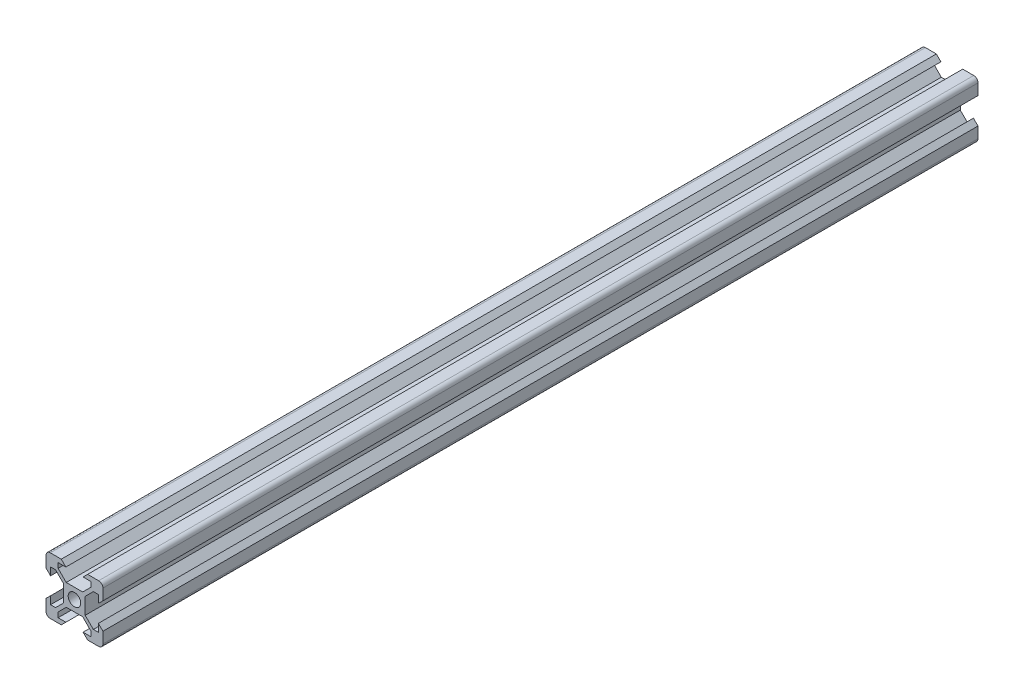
SolidWorks part; units mm, degrees
ref_plane "Front Plane" through (0, 0, 0) normal (0, 0, 1) x (1, 0, 0)
ref_plane "Top Plane" through (0, 0, 0) normal (0, 1, 0) x (1, 0, 0)
ref_plane "Right Plane" through (0, 0, 0) normal (1, 0, 0) x (0, 0, -1)
sketch "Sketch1" plane through (0, 0, 0) normal (0, 0, 1) x (1, 0, 0)
  line L0 (-5.7847, 7.544) -> (-11.512, 13.2713)
  line L1 (-7.544, 7.544) -> (7.544, 7.544)
  line L2 (-7.544, 7.544) -> (-7.544, -7.544)
  line L3 (-7.544, -7.544) -> (7.544, -7.544)
  line L4 (7.544, 7.544) -> (7.544, -7.544)
  line L5 (-7.544, 7.544) -> (7.544, -7.544) construction
  line L6 (-7.544, -7.544) -> (7.544, 7.544) construction
  line L7 (-11.512, 13.2713) -> (-11.512, 16.8)
  line L8 (-11.512, 16.8) -> (-6.052, 16.8)
  line L9 (-6.052, 16.8) -> (-9.252, 20)
  line L10 (-9.252, 20) -> (-17, 20)
  line L11 (-20, 17) -> (-20, 9.252)
  line L12 (-20, 9.252) -> (-16.8, 6.052)
  line L13 (-16.8, 6.052) -> (-16.8, 11.512)
  line L14 (-16.8, 11.512) -> (-13.2713, 11.512)
  line L15 (-13.2713, 11.512) -> (-7.544, 5.7847)
  line L16 (-19.1213, 19.1213) -> (0, 0) construction
  line L17 (13.2713, 11.512) -> (16.8, 11.512)
  line L18 (20, 9.252) -> (20, 17)
  line L19 (17, 20) -> (9.252, 20)
  line L20 (9.252, 20) -> (6.052, 16.8)
  line L21 (6.052, 16.8) -> (11.512, 16.8)
  line L22 (11.512, 16.8) -> (11.512, 13.2713)
  line L23 (11.512, 13.2713) -> (5.7847, 7.544)
  line L24 (7.544, 5.7847) -> (13.2713, 11.512)
  line L25 (16.8, 11.512) -> (16.8, 6.052)
  line L26 (16.8, 6.052) -> (20, 9.252)
  line L27 (19.1213, 19.1213) -> (0, 0) construction
  line L28 (11.512, -13.2713) -> (11.512, -16.8)
  line L29 (9.252, -20) -> (17, -20)
  line L30 (20, -17) -> (20, -9.252)
  line L31 (20, -9.252) -> (16.8, -6.052)
  line L32 (16.8, -6.052) -> (16.8, -11.512)
  line L33 (16.8, -11.512) -> (13.2713, -11.512)
  line L34 (13.2713, -11.512) -> (7.544, -5.7847)
  line L35 (5.7847, -7.544) -> (11.512, -13.2713)
  line L36 (11.512, -16.8) -> (6.052, -16.8)
  line L37 (6.052, -16.8) -> (9.252, -20)
  line L38 (19.1213, -19.1213) -> (0, 0) construction
  line L39 (-13.2713, -11.512) -> (-16.8, -11.512)
  line L40 (-20, -9.252) -> (-20, -17)
  line L41 (-17, -20) -> (-9.252, -20)
  line L42 (-9.252, -20) -> (-6.052, -16.8)
  line L43 (-6.052, -16.8) -> (-11.512, -16.8)
  line L44 (-11.512, -16.8) -> (-11.512, -13.2713)
  line L45 (-11.512, -13.2713) -> (-5.7847, -7.544)
  line L46 (-7.544, -5.7847) -> (-13.2713, -11.512)
  line L47 (-16.8, -11.512) -> (-16.8, -6.052)
  line L48 (-16.8, -6.052) -> (-20, -9.252)
  line L49 (-19.1213, -19.1213) -> (0, 0) construction
  circle A0 centre (0, 0) radius 4.4
  arc A1 (-17, 20) -> (-20, 17) centre (-17, 17) ccw
  arc A2 (20, 17) -> (17, 20) centre (17, 17) ccw
  arc A3 (17, -20) -> (20, -17) centre (17, -17) ccw
  arc A4 (-20, -17) -> (-17, -20) centre (-17, -17) ccw
  point P66 (0, 0)
  dimension "D1" = 8.8
  dimension "D8" = 3
  dimension "D2" = 15.088
  dimension "D3" = 2.488
  dimension "D4" = 8.488
  dimension "D5" = 3.2
  dimension "D6" = 20
  dimension "D7" = 15.2
  dimension "D9" = 4
extrude "Boss-Extrude1" add sketch "Sketch1" along normal mid plane 615 contours L10 A1 L11 L12 L13 L14 L15 L2 L1 L0 L7 L8 L9 | L18 A2 L19 L20 L21 L22 L23 L1 L4 L24 L17 L25 L26 | L40 A4 L41 L42 L43 L44 L45 L3 L2 L46 L39 L47 L48 | L29 A3 L30 L31 L32 L33 L34 L4 L3 L35 L28 L36 L37 | L4 L1 L2 L3 A0
equation "\"longitud\"= 600mm"
